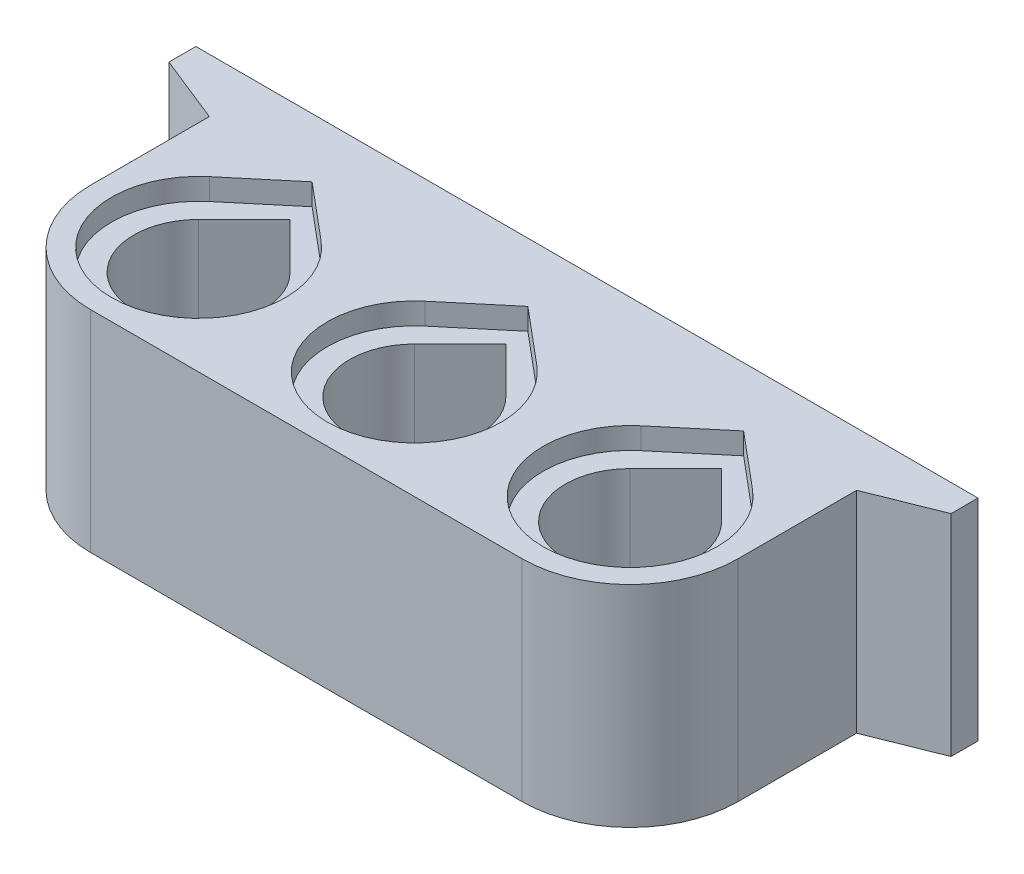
SolidWorks part; units mm, degrees
ref_plane "Ebene vorne" through (0, 0, 0) normal (0, 0, 1) x (1, 0, 0)
ref_plane "Ebene oben" through (0, 0, 0) normal (0, 1, 0) x (1, 0, 0)
ref_plane "Ebene rechts" through (0, 0, 0) normal (1, 0, 0) x (0, 0, -1)
sketch "Skizze1" plane through (0, 0, 0) normal (0, 1, 0) x (1, 0, 0)
  line L0 (0, 8.4) -> (32.1191, 8.4) construction
  line L1 (0, 0) -> (24, 0)
  line L2 (0, 0) -> (0, 8.4)
  line L3 (0, 10.4) -> (24, 10.4)
  line L4 (24, 0) -> (24, 8.4)
  line L5 (0, 10.4) -> (-2.5, 10.4)
  line L6 (-2.5, 10.4) -> (-2.5, 9.4)
  line L7 (-2.5, 9.4) -> (0, 8.4)
  line L8 (12, 0) -> (12, 10.4) construction
  line L9 (26.5, 9.4) -> (24, 8.4)
  line L10 (26.5, 10.4) -> (26.5, 9.4)
  line L11 (24, 10.4) -> (26.5, 10.4)
  line L12 (4, 4) -> (4, 8.2245) construction
  line L13 (4, 7.3941) -> (5.6971, 5.6971)
  line L14 (4, 7.3941) -> (2.3029, 5.6971)
  line L15 (12, 7.3941) -> (13.6971, 5.6971)
  line L16 (12, 7.3941) -> (10.3029, 5.6971)
  line L17 (20, 7.3941) -> (21.6971, 5.6971)
  line L18 (20, 7.3941) -> (18.3029, 5.6971)
  arc A0 (2.3029, 5.6971) -> (5.6971, 5.6971) centre (4, 4) ccw
  arc A3 (10.3029, 5.6971) -> (13.6971, 5.6971) centre (12, 4) ccw
  arc A4 (18.3029, 5.6971) -> (21.6971, 5.6971) centre (20, 4) ccw
  dimension "D1" = 4.8
  dimension "D2" = 4
  dimension "D3" = 4
  dimension "D4" = 8.4
  dimension "D6" = 3
  dimension "D7" = 2
  dimension "D8" = 2.5
  dimension "D9" = 1
  dimension "D5" = 90
extrude "Aufsatz-Linear austragen1" add sketch "Skizze1" along normal blind 7.8
sketch "Skizze2" plane through (0, 7.8, 0) normal (0, 1, 0) x (1, 0, 0)
  line L0 (4, 4) -> (4, 10.1316) construction
  line L1 (4, 8.2099) -> (1.927, 6.4705)
  line L2 (4, 8.2099) -> (6.073, 6.4705)
  line L3 (12, 8.2099) -> (9.927, 6.4705)
  line L4 (12, 8.2099) -> (14.073, 6.4705)
  line L5 (20, 8.2099) -> (17.927, 6.4705)
  line L6 (20, 8.2099) -> (22.073, 6.4705)
  arc A0 (1.927, 6.4705) -> (6.073, 6.4705) centre (4, 4) ccw
  arc A3 (9.927, 6.4705) -> (14.073, 6.4705) centre (12, 4) ccw
  arc A4 (17.927, 6.4705) -> (22.073, 6.4705) centre (20, 4) ccw
  dimension "D1" = 6.45
  dimension "D3" = 100
  dimension "D2" = 3
extrude "Schnitt-Linear austragen1" cut sketch "Skizze2" against normal blind 0.8
ref_plane "Ebene1" through (0, 3.9, 0) normal (0, 1, 0) x (1, 0, 0)
mirror "Spiegeln1" about plane through (0, 3.9, 0) normal (0, 1, 0) of "Schnitt-Linear austragen1"
fillet "Verrundung1" radius 4 2 edges at (0, 3.9, 0) (24, 3.9, 0)
